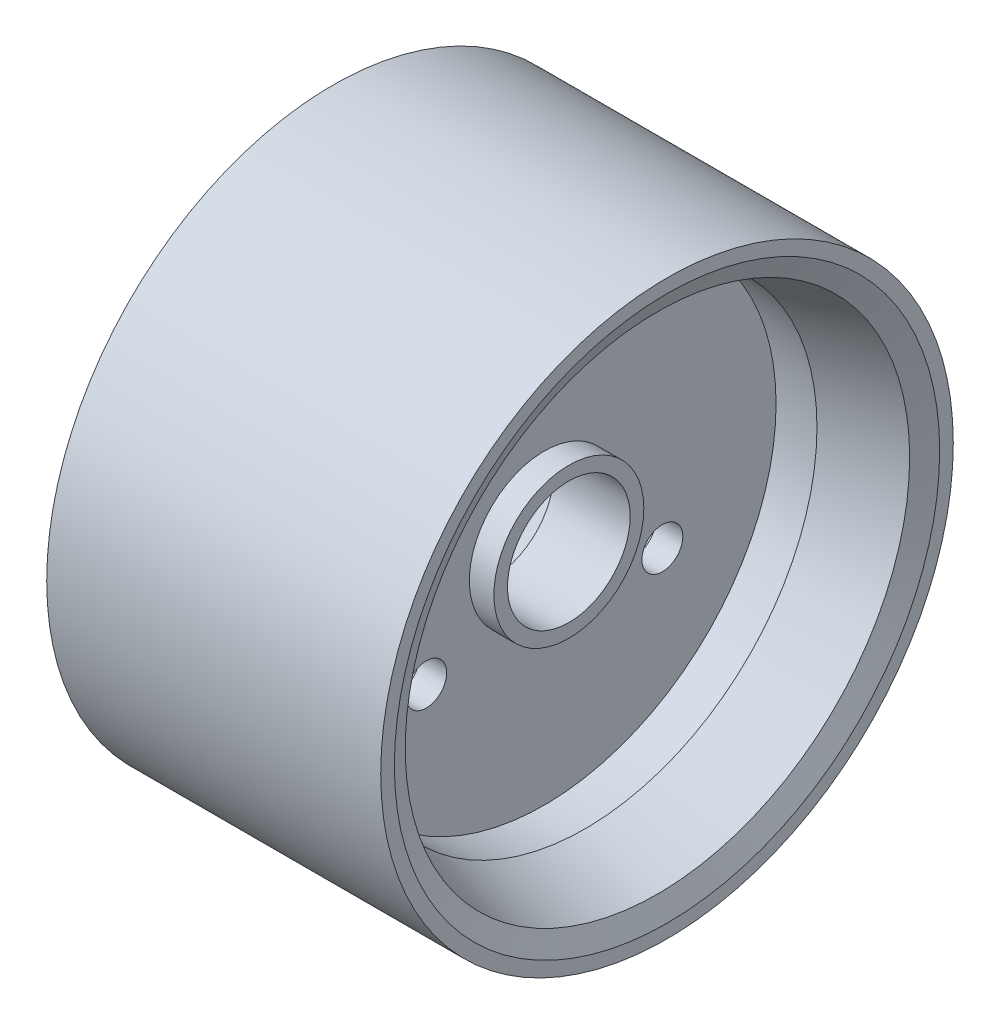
SolidWorks part; units mm, degrees
ref_plane "Plan de face" through (0, 0, 0) normal (0, 0, 1) x (1, 0, 0)
ref_plane "Plan de dessus" through (0, 0, 0) normal (0, 1, 0) x (1, 0, 0)
ref_plane "Plan de droite" through (0, 0, 0) normal (1, 0, 0) x (0, 0, -1)
sketch "Esquisse1" plane through (0, 0, 0) normal (0, 0, 1) x (1, 0, 0)
  line L0 (18.3819, 0) -> (-3.4878, 0) construction
  line L1 (0, 33.3088) -> (0, -5.5295) construction
  line L2 (18.3819, 21) -> (-3.4878, 21) construction
  line L3 (9, 38.9267) -> (9, -5.5295) construction
  line L4 (-3.8, 4.5) -> (1.8, 4.5)
  line L5 (7.6818, 4.5) -> (-5.3738, 4.5) construction
  line L6 (6.9504, 5.5) -> (-2, 5.5) construction
  line L7 (1.8, 14.8484) -> (1.8, 2.7761) construction
  line L8 (-15.5, 38.9267) -> (-15.5, -5.5295) construction
  line L9 (-1, 22.5789) -> (-1, 6.1095) construction
  line L10 (1.8, 5.5) -> (1.8, 4.5)
  line L11 (1.8, 5.5) -> (0, 5.5)
  line L12 (-3.8, 5.5) -> (-3.8, 4.5)
  line L13 (-3.8, 5.5) -> (-2, 5.5)
  line L14 (14.8003, 17) -> (-3.1505, 17) construction
  line L15 (11.9461, 20) -> (6.9504, 20) construction
  line L16 (15.9344, 18.5) -> (5.8505, 18.5) construction
  line L17 (0, 5.5) -> (0, 17)
  line L18 (-2, 5.5) -> (-2, 17)
  line L19 (8.3, 27.2147) -> (8.3, 17.6991) construction
  line L20 (-3.25, 35.3107) -> (-3.25, 19.582) construction
  line L21 (3, 20.7328) -> (3, 16.3551) construction
  line L22 (0, 17) -> (3, 17)
  line L23 (3, 17) -> (8.3, 18.5)
  line L24 (8.3, 18.5) -> (9, 20)
  line L25 (9, 20) -> (9, 21)
  line L26 (-9.5, 17) -> (-14.8, 18.5)
  line L27 (-14.8, 18.5) -> (-15.5, 20)
  line L28 (-15.5, 20) -> (-15.5, 21)
  line L29 (-9.5, 17) -> (-2, 17)
  line L30 (-15.5, 21) -> (9, 21)
  dimension "D1" = 9
  dimension "D2" = 21
  dimension "D3" = 17
  dimension "D4" = 1
  dimension "D5" = 4.5
  dimension "D6" = 1.8
  dimension "D7" = 24.5
  dimension "D8" = 1
  dimension "D9" = 1
  dimension "D10" = 2.5
  dimension "D11" = 0.7
  dimension "D12" = 12.25
  dimension "D13" = 3
revolve "Révolution2" add sketch "Esquisse1" angle 360 about L0
sketch "Esquisse2" plane through (0, 0, 0) normal (1, 0, 0) x (0, 0, -1)
  line L0 (0, -1.6614) -> (0, 23.4818) construction
  line L1 (26.1955, 0) -> (-2.3814, 0) construction
  line L2 (26.1955, 10) -> (-2.0491, 10) construction
  circle A0 centre (0, 10) radius 1.5
  circle A1 centre (8.6603, -5) radius 1.5
  circle A2 centre (-8.6603, -5) radius 1.5
  point P15 (0, 0)
  dimension "D2" = 3
  dimension "D1" = 10
extrude "Enlèv. mat.-Extru.1" cut sketch "Esquisse2" against normal blind 2
